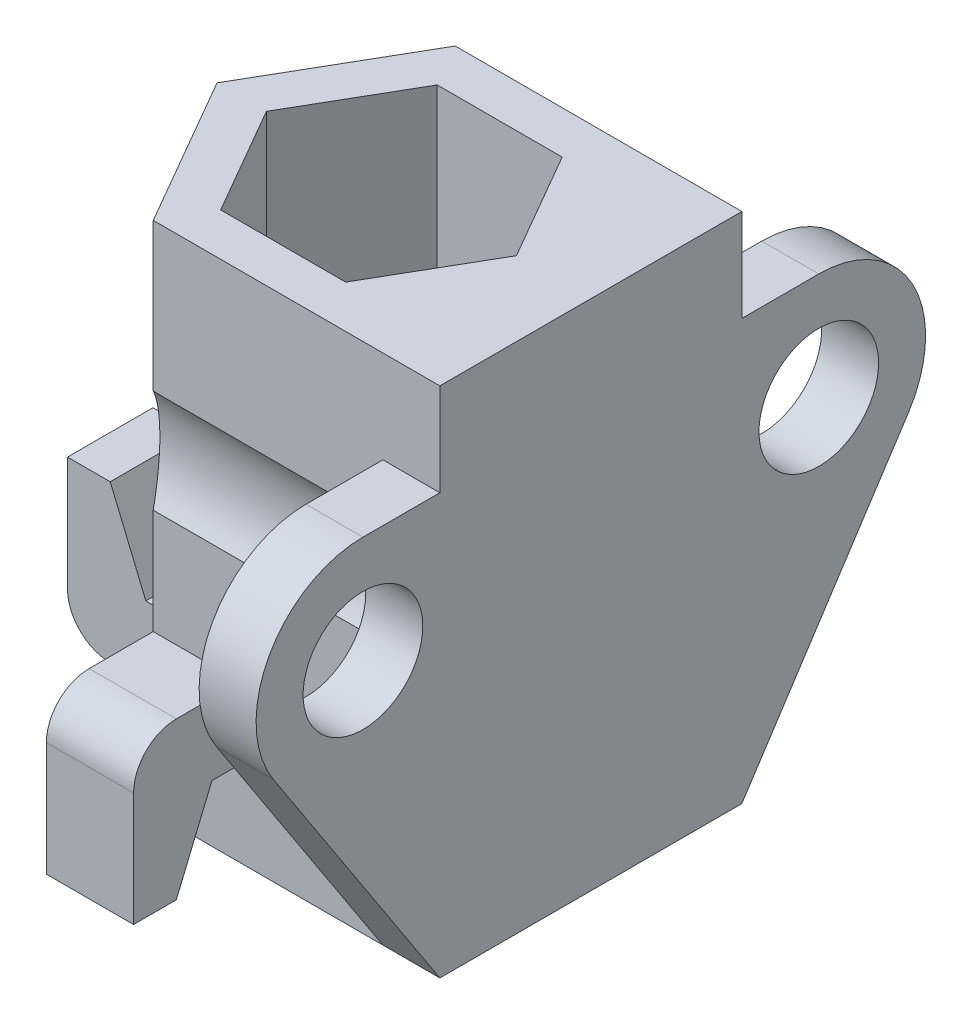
SolidWorks part; units mm, degrees
ref_plane "Plan de face" through (0, 0, 0) normal (0, 0, 1) x (1, 0, 0)
ref_plane "Plan de dessus" through (0, 0, 0) normal (0, 1, 0) x (1, 0, 0)
ref_plane "Plan de droite" through (0, 0, 0) normal (1, 0, 0) x (0, 0, -1)
sketch "Esquisse2" plane through (0, 0, 0) normal (0, 1, 0) x (1, 0, 0)
  line L0 (0, 0) -> (4.3879, 0) construction
  line L1 (4.3879, 0) -> (2.1939, 3.8)
  line L2 (2.1939, 3.8) -> (-2.1939, 3.8)
  line L3 (-2.1939, 3.8) -> (-4.3879, 0)
  line L4 (-4.3879, 0) -> (-2.1939, -3.8)
  line L5 (-2.1939, -3.8) -> (2.1939, -3.8)
  line L6 (2.1939, -3.8) -> (4.3879, 0)
  line L7 (3.06, 5.3) -> (-3.06, 5.3)
  line L8 (-3.06, 5.3) -> (-6.1199, 0)
  line L9 (-6.1199, 0) -> (-3.06, -5.3)
  line L10 (-3.06, -5.3) -> (3.06, -5.3)
  line L13 (3.06, 5.3) -> (7, 5.3)
  line L14 (7, 5.3) -> (7, -5.3)
  line L15 (7, -5.3) -> (3.06, -5.3)
  line L17 (6.1199, 0) -> (3.06, 5.3) construction
  line L18 (3.06, -5.3) -> (6.1199, 0) construction
  circle A0 centre (0, 0) radius 3.8 construction
  dimension "D1" = 7.6
  dimension "D3" = 7
  dimension "D2" = 1.5
extrude "Boss.-Extru.1" add sketch "Esquisse2" along normal blind 18
sketch "Esquisse4" plane through (7, 0, 0) normal (1, 0, 0) x (0, 0, -1)
  line L0 (0, 18) -> (0, 0) construction
  line L1 (-5.3, 18) -> (5.3, 18) construction
  line L2 (-5.3, 0) -> (5.3, 0) construction
  line L3 (-11.1405, 8.9507) -> (-5.3, 0)
  line L4 (-5.3, 18) -> (-5.3, 0) construction
  line L5 (-8, 14.75) -> (-5.3, 14.75)
  line L6 (-5.3, 14.75) -> (-5.3, 0)
  line L7 (5.3, 14.75) -> (5.3, 0)
  line L8 (8, 14.75) -> (5.3, 14.75)
  line L9 (11.1405, 8.9507) -> (5.3, 0)
  circle A0 centre (-8, 11) radius 2.1
  arc A1 (-8, 14.75) -> (-11.1405, 8.9507) centre (-8, 11) ccw
  arc A2 (8, 14.75) -> (11.1405, 8.9507) centre (8, 11) cw
  circle A3 centre (8, 11) radius 2.1
  dimension "D1" = 4.2
  dimension "D4" = 7.5
  dimension "D2" = 11
  dimension "D3" = 8
extrude "Boss.-Extru.2" add sketch "Esquisse4" against normal blind 2
sketch "Esquisse6" plane through (0, 0, 0) normal (1, 0, 0) x (0, 0, -1)
  line L0 (5.3, 3) -> (6.3, 3)
  line L1 (5.3, 14.75) -> (5.3, 0) construction
  line L2 (6.3, 3) -> (7.55, 0)
  line L3 (7.55, 0) -> (9.05, 0)
  line L4 (9.05, 0) -> (9.05, 5.5)
  line L5 (9.05, 5.5) -> (5.3, 5.5)
  line L6 (5.3, 18) -> (5.3, 0) construction
  line L7 (5.3, 5.5) -> (5.3, 3)
  line L8 (0, 0) -> (0, 18) construction
  line L9 (5.3, 0) -> (0, 0) construction
  line L10 (-5.3, 5.5) -> (-5.3, 3)
  line L11 (-9.05, 5.5) -> (-5.3, 5.5)
  line L12 (-9.05, 0) -> (-9.05, 5.5)
  line L13 (-7.55, 0) -> (-9.05, 0)
  line L14 (-6.3, 3) -> (-7.55, 0)
  line L15 (-5.3, 3) -> (-6.3, 3)
  dimension "D1" = 1
  dimension "D2" = 1.25
  dimension "D3" = 3
  dimension "D4" = 1.5
  dimension "D6" = 2.5
extrude "Boss.-Extru.3" add sketch "Esquisse6" against normal up to vertex (3.06 mm away)
sketch "Esquisse7" plane through (0, 0, 0) normal (0, 0, 1) x (1, 0, 0)
  line L0 (-6.1199, 0) -> (-9.8699, 0)
  line L1 (-9.8699, 0) -> (-9.8699, 5.5)
  line L2 (-9.8699, 5.5) -> (-8.3699, 5.5)
  line L3 (-8.3699, 5.5) -> (-7.1199, 2.5)
  line L4 (-7.1199, 2.5) -> (-6.1199, 2.5)
  line L5 (-6.1199, 18) -> (-6.1199, 0) construction
  line L6 (-6.1199, 2.5) -> (-6.1199, 0)
  dimension "D1" = 1.5
  dimension "D2" = 1
  dimension "D3" = 1.25
  dimension "D4" = 3
  dimension "D5" = 2.5
extrude "Boss.-Extru.4" add sketch "Esquisse7" along normal blind 1.5 and the other way blind 1.5 separate body
sketch "Esquisse8" plane through (-6.1199, 0, 0) normal (1, 0, 0) x (0, 0, -1)
  line L4 (1.5, 2.5) -> (-1.5, 2.5)
  line L5 (-1.5, 2.5) -> (-1.5, 0)
  line L6 (-1.5, 0) -> (1.5, 0)
  line L7 (1.5, 0) -> (1.5, 2.5)
  line L8 (1.5, 2.5) -> (-1.5, 2.5)
  line L9 (-1.5, 2.5) -> (-1.5, 0)
  line L10 (-1.5, 0) -> (1.5, 0)
  line L11 (1.5, 0) -> (1.5, 2.5)
  dimension "D1" = 0
extrude "Boss.-Extru.5" add sketch "Esquisse8" along normal up to next (1.7321 mm away)
fillet "Congé5" radius 1.5 3 edges at (-1.53, 5.5, 9.05) (-9.8699, 0, 0) (-1.53, 5.5, -9.05)
sketch "Esquisse9" plane through (5, 0, 0) normal (-1, 0, 0) x (0, 0, 1)
  line L0 (-5.3, 12.809) -> (-5.3, 9.191)
  line L1 (-5.3, 18) -> (-5.3, 5.5) construction
  line L2 (-5.3, 14.75) -> (-5.3, 0) construction
  line L3 (0, 18) -> (0, 5.5) construction
  line L4 (-1.5, 5.5) -> (1.5, 5.5) construction
  line L5 (5.3, 12.809) -> (5.3, 9.191)
  arc A0 (-5.3, 9.191) -> (-5.3, 12.809) centre (-8, 11) ccw
  circle A1 centre (-8, 11) radius 2.1 construction
  arc A2 (5.3, 9.191) -> (5.3, 12.809) centre (8, 11) cw
  dimension "D1" = 6.5
extrude "Enlèv. mat.-Extru.2" cut sketch "Esquisse9" along normal up to vertex (11.1199 mm away)
chamfer "Chanfrein1" distance 1.25 distance2 0.75 6 edges at (0, 0, 3.8) (-3.2909, 0, 1.9) (-3.2909, 0, -1.9) (0, 0, -3.8) (3.2909, 0, -1.9) (3.2909, 0, 1.9)
